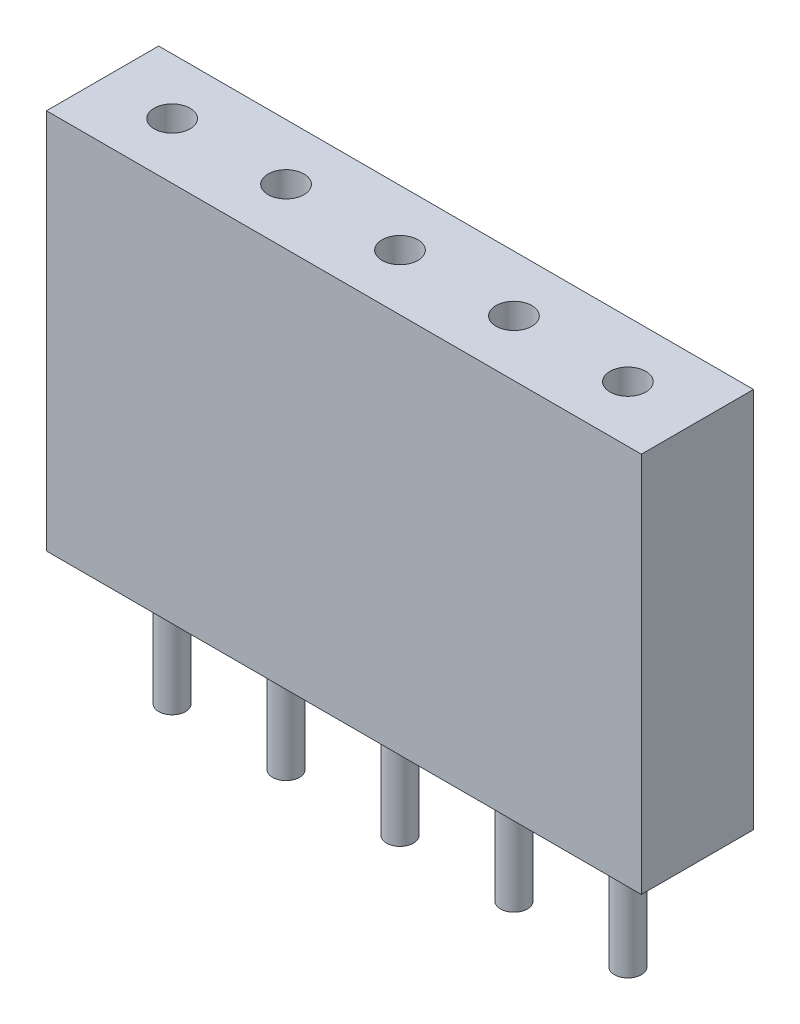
SolidWorks part; units mm, degrees
ref_plane "Plan de face" through (0, 0, 0) normal (0, 0, 1) x (1, 0, 0)
ref_plane "Plan de dessus" through (0, 0, 0) normal (0, 1, 0) x (1, 0, 0)
ref_plane "Plan de droite" through (0, 0, 0) normal (1, 0, 0) x (0, 0, -1)
sketch "Esquisse1" plane through (0, 0, 0) normal (0, 0, 1) x (1, 0, 0)
  line L1 (0, 0) -> (13.26, 0)
  line L2 (0, 0) -> (0, 8.5)
  line L3 (0, 8.5) -> (13.26, 8.5)
  line L4 (13.26, 0) -> (13.26, 8.5)
extrude "Boss.-Extru.1" add sketch "Esquisse1" along normal blind 2.5
sketch "Esquisse2" plane through (0, 0, 0) normal (0, -1, 0) x (1, 0, 0)
  line L0 (14.8407, 1.25) -> (-0.3805, 1.25) construction
  line L1 (6.63, -1.2391) -> (6.63, 2.2525) construction
  circle A0 centre (6.63, 1.25) radius 0.3
  circle A1 centre (9.17, 1.25) radius 0.3
  circle A2 centre (11.71, 1.25) radius 0.3
  circle A3 centre (4.09, 1.25) radius 0.3
  circle A4 centre (1.55, 1.25) radius 0.3
  dimension "D1" = 3
  dimension "D2" = 3
extrude "Boss.-Extru.2" add sketch "Esquisse2" along normal blind 2.8
sketch "Esquisse3" plane through (0, 8.5, 0) normal (0, 1, 0) x (1, 0, 0)
  line L0 (14.5679, -1.25) -> (-0.3805, -1.25) construction
  line L1 (6.63, -3.6027) -> (6.63, -0.4521) construction
  circle A0 centre (6.63, -1.25) radius 0.4
  circle A1 centre (9.17, -1.25) radius 0.4
  circle A2 centre (11.71, -1.25) radius 0.4
  circle A3 centre (4.09, -1.25) radius 0.4
  circle A4 centre (1.55, -1.25) radius 0.4
  dimension "D1" = 3
  dimension "D2" = 3
extrude "Enlèv. mat.-Extru.1" cut sketch "Esquisse3" against normal blind 7
